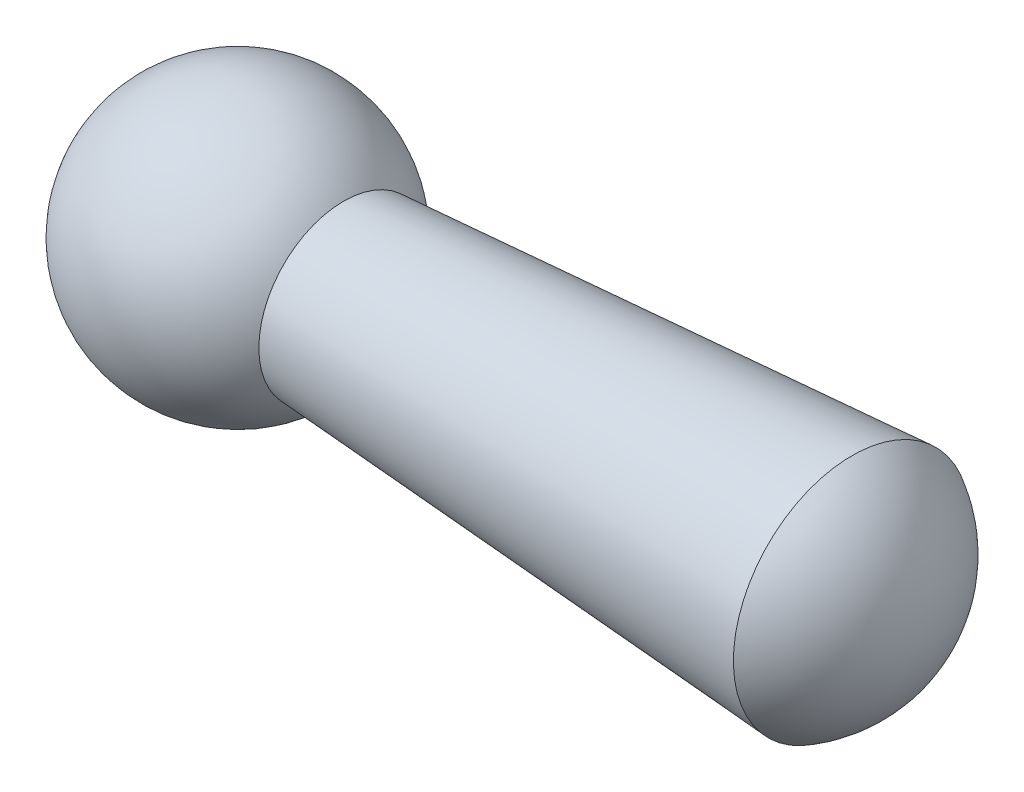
SolidWorks part; units mm, degrees
ref_plane "Plan de face" through (0, 0, 0) normal (0, 0, 1) x (1, 0, 0)
ref_plane "Plan de dessus" through (0, 0, 0) normal (0, 1, 0) x (1, 0, 0)
ref_plane "Plan de droite" through (0, 0, 0) normal (1, 0, 0) x (0, 0, -1)
sketch "Esquisse1" plane through (0, 0, 0) normal (0, 0, 1) x (1, 0, 0)
  line L0 (-9.1227, 0) -> (-8.7012, 0) construction
  line L1 (17.3661, 0) -> (-6.5289, 0) construction
  line L2 (3.1225, 2.5) -> (18.1225, 3.5)
  line L3 (-4, 0) -> (20.186, 0)
  arc A0 (3.1225, 2.5) -> (-4, 0) centre (0, 0) ccw
  arc A1 (20.186, 0) -> (18.1225, 3.5) centre (16.186, 0) ccw
  dimension "D1" = 4
  dimension "D5" = 4
  dimension "D2" = 15
  dimension "D3" = 2.5
  dimension "D4" = 3.5
revolve "Révolution1" add sketch "Esquisse1" angle 360 about L3
